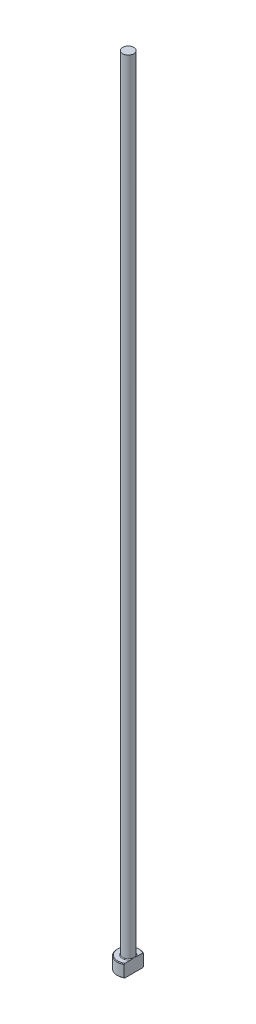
SolidWorks part; units mm, degrees
ref_plane "Front Plane" through (0, 0, 0) normal (0, 0, 1) x (1, 0, 0)
ref_plane "Top Plane" through (0, 0, 0) normal (0, 1, 0) x (1, 0, 0)
ref_plane "Right Plane" through (0, 0, 0) normal (1, 0, 0) x (0, 0, -1)
sketch "Sketch1" plane through (0, 0, 0) normal (0, 0, 1) x (1, 0, 0)
  line L0 (0, 259.9588) -> (0, -15.1925) construction
  line L1 (0, 0) -> (-3.5, 0)
  line L2 (-3.5, 0) -> (-3.5, 4)
  line L3 (-3.5, 4) -> (-1.75, 4)
  line L4 (-1.75, 4) -> (-1.75, 250)
  line L5 (-1.75, 250) -> (0, 250)
  line L6 (0, 250) -> (0, 0)
  dimension "L" = 250
  dimension "H" = 7
  dimension "T" = 4
  dimension "D" = 3.5
revolve "Revolve1" add sketch "Sketch1" angle 360 about L0
chamfer "Chamfer1" distance 0.2 angle 45 2 edges at (0, 4, 3.5) (0, 0, 3.5)
fillet "Fillet1" radius 0.2 1 edges at (0, 4, 1.75)
sketch "Sketch2" plane through (0, 0, 0) normal (0, 1, 0) x (1, 0, 0)
  line L0 (1.75, -3.0311) -> (1.75, 3.0311)
  circle A0 centre (0, 0) radius 3.5 construction
  arc A1 (1.75, -3.0311) -> (1.75, 3.0311) centre (0, 0) ccw
  circle A2 centre (0, 0) radius 1.75 construction
extrude "KEYED HEAD" cut sketch "Sketch2" along normal through all
